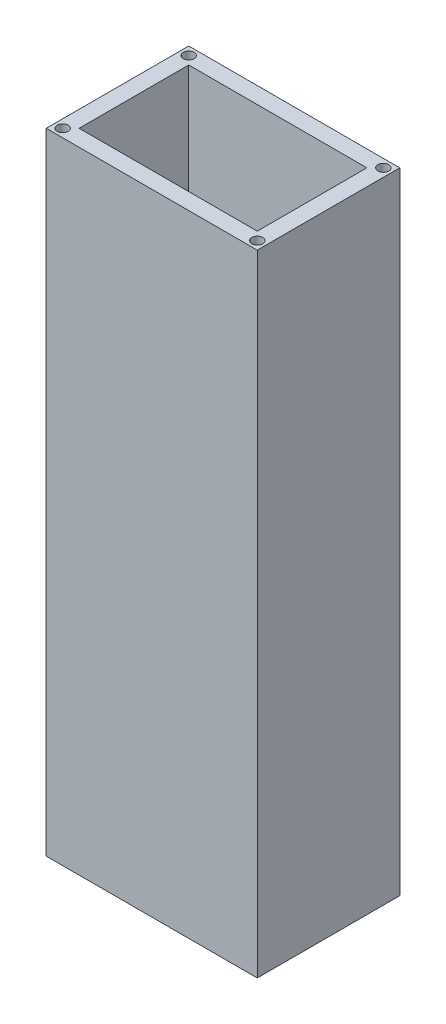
SolidWorks part; units mm, degrees
ref_plane "Alzado" through (0, 0, 0) normal (0, 0, 1) x (1, 0, 0)
ref_plane "Planta" through (0, 0, 0) normal (0, 1, 0) x (1, 0, 0)
ref_plane "Vista lateral" through (0, 0, 0) normal (1, 0, 0) x (0, 0, -1)
sketch "Croquis1" plane through (0, 0, 0) normal (0, 1, 0) x (1, 0, 0)
  line L0 (-38.5, 26) -> (38.5, 26)
  line L1 (-32.5, -20) -> (32.5, -20)
  line L2 (-32.5, -20) -> (-32.5, 20)
  line L3 (-32.5, 20) -> (32.5, 20)
  line L4 (32.5, -20) -> (32.5, 20)
  line L5 (-32.5, -20) -> (32.5, 20) construction
  line L6 (-32.5, 20) -> (32.5, -20) construction
  line L7 (38.5, -26) -> (38.5, 26)
  line L8 (-38.5, -26) -> (38.5, -26)
  line L9 (-38.5, -26) -> (-38.5, 26)
  line L10 (0, 0) -> (14.1442, 0) construction
  line L11 (0, 8.4349) -> (0, 0) construction
  circle A0 centre (35.5, 23) radius 2
  circle A1 centre (35.5, -23) radius 2
  circle A2 centre (-35.5, -23) radius 2
  circle A3 centre (-35.5, 23) radius 2
  point P0 (0, 0)
  dimension "D4" = 4
  dimension "D1" = 40
  dimension "D2" = 65
  dimension "D5" = 3
  dimension "D6" = 3
  dimension "D3" = 6
extrude "Saliente-Extruir1" add sketch "Croquis1" along normal blind 230
sketch "Croquis4" plane through (0, 0, 0) normal (0, 0, 1) x (1, 0, 0)
  line L1 (-15, 55) -> (15, 55)
  line L2 (-15, 55) -> (-15, 85)
  line L3 (-15, 85) -> (15, 85)
  line L4 (15, 55) -> (15, 85)
  line L5 (-15, 55) -> (15, 85) construction
  line L6 (-15, 85) -> (15, 55) construction
  point P0 (0, 70)
  dimension "D1" = 55
  dimension "D2" = 30
  dimension "D3" = 30
extrude "Cortar-Extruir2" cut sketch "Croquis4" against normal through all
